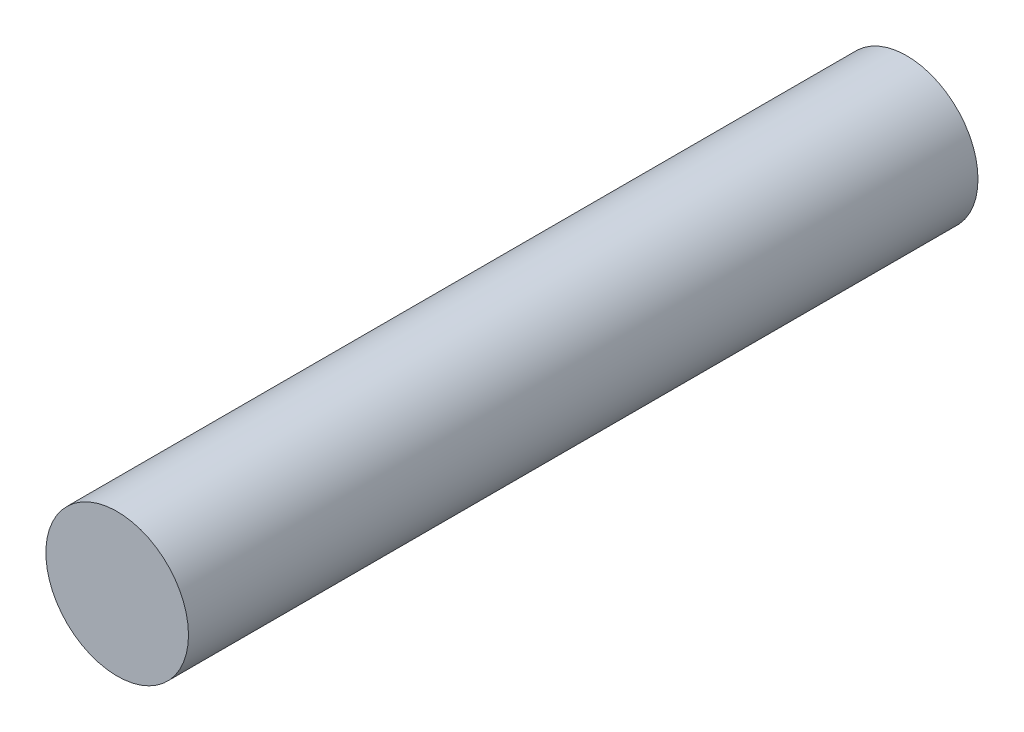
SolidWorks part; units mm, degrees
ref_plane "Front" through (0, 0, 0) normal (0, 0, 1) x (1, 0, 0)
ref_plane "Top" through (0, 0, 0) normal (0, 1, 0) x (1, 0, 0)
ref_plane "Right" through (0, 0, 0) normal (1, 0, 0) x (0, 0, -1)
sketch "Esquisse1" plane through (0, 0, 0) normal (0, 0, 1) x (1, 0, 0)
  circle A0 centre (0, 0) radius 14
  dimension "D1" = 28
extrude "Boss.-Extru.1" add sketch "Esquisse1" along normal blind 155
